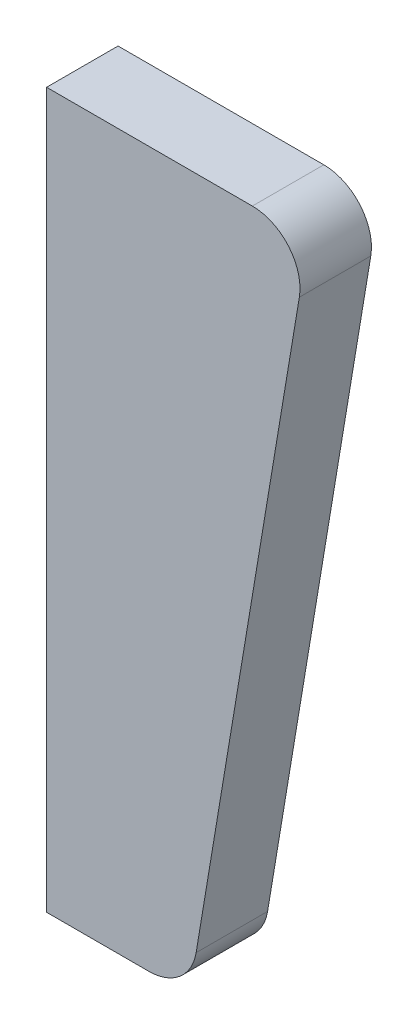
SolidWorks part; units mm, degrees
ref_plane "Plan de face" through (0, 0, 0) normal (0, 0, 1) x (1, 0, 0)
ref_plane "Plan de dessus" through (0, 0, 0) normal (0, 1, 0) x (1, 0, 0)
ref_plane "Plan de droite" through (0, 0, 0) normal (1, 0, 0) x (0, 0, -1)
sketch "Esquisse1" plane through (0, 0, 0) normal (0, 0, 1) x (1, 0, 0)
  line L0 (-1.5549, -2.3486) -> (18.8854, -2.3486) construction
  line L1 (-1.5549, -2.3486) -> (2.4451, -2.3486)
  line L2 (-1.5549, -2.3486) -> (-1.5549, -32.3486)
  line L3 (-1.5549, -32.3486) -> (2.7508, -32.3486)
  line L5 (4.7236, -30.6774) -> (9.0569, -4.6774)
  line L6 (7.0841, -2.3486) -> (2.4451, -2.3486)
  arc A0 (9.0569, -4.6774) -> (7.0841, -2.3486) centre (7.0841, -4.3486) ccw
  arc A1 (2.7508, -32.3486) -> (4.7236, -30.6774) centre (2.7508, -30.3486) ccw
  point P8 (9.4451, -2.3486)
  point P11 (4.4451, -32.3486)
  dimension "D4" = 2
  dimension "D1" = 6
  dimension "D2" = 30
  dimension "D3" = 11
extrude "Boss.-Extru.1" add sketch "Esquisse1" along normal blind 3
